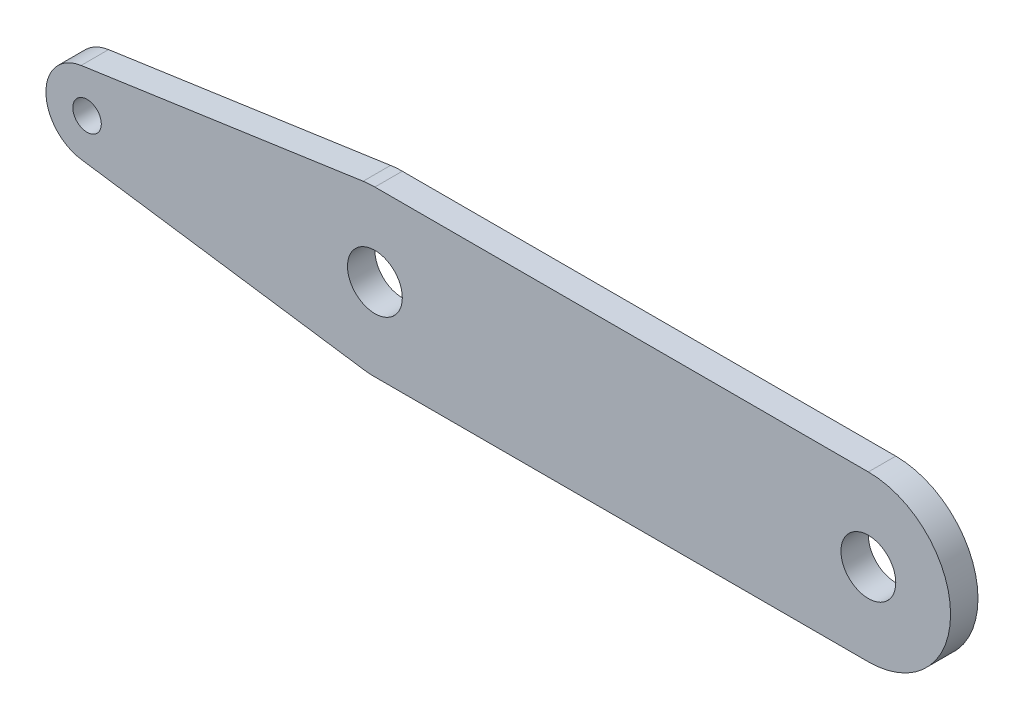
SolidWorks part; units mm, degrees
ref_plane "Front Plane" through (0, 0, 0) normal (0, 0, 1) x (1, 0, 0)
ref_plane "Top Plane" through (0, 0, 0) normal (0, 1, 0) x (1, 0, 0)
ref_plane "Right Plane" through (0, 0, 0) normal (1, 0, 0) x (0, 0, -1)
sketch "Sketch1" plane through (0, 0, 0) normal (0, 0, 1) x (1, 0, 0)
  line L0 (142.875, 76.2) -> (-28.575, 76.2) construction
  line L1 (0, 0) -> (114.3, 0) construction
  line L2 (57.15, 76.2) -> (57.15, 0) construction
  line L3 (-66.675, 0) -> (0, 0) construction
  line L4 (-68.0357, 9.4273) -> (-2.7214, 18.8546)
  line L5 (-2.7214, -18.8546) -> (-68.0357, -9.4273)
  line L6 (0, -19.05) -> (114.3, -19.05)
  line L7 (114.3, 19.05) -> (0, 19.05)
  circle A0 centre (0, 0) radius 6.35
  circle A1 centre (114.3, 0) radius 6.35
  circle A2 centre (142.875, 76.2) radius 6.35 construction
  circle A3 centre (-28.575, 76.2) radius 6.35 construction
  circle A4 centre (-66.675, 0) radius 3.302
  arc A5 (-68.0357, 9.4273) -> (-68.0357, -9.4273) centre (-66.675, 0) ccw
  arc A6 (-2.7214, -18.8546) -> (0, -19.05) centre (0, 0) ccw
  arc A7 (114.3, -19.05) -> (114.3, 19.05) centre (114.3, 0) ccw
  arc A8 (0, 19.05) -> (-2.7214, 18.8546) centre (0, 0) ccw
  dimension "D3" = 12.7
  dimension "D4" = 12.7
  dimension "D7" = 6.604
  dimension "D8" = 19.05
  dimension "D9" = 12.7
  dimension "D1" = 114.3
  dimension "D2" = 171.45
  dimension "D5" = 76.2
  dimension "D6" = 38.1
extrude "Boss-Extrude1" add sketch "Sketch1" along normal blind 6.35
